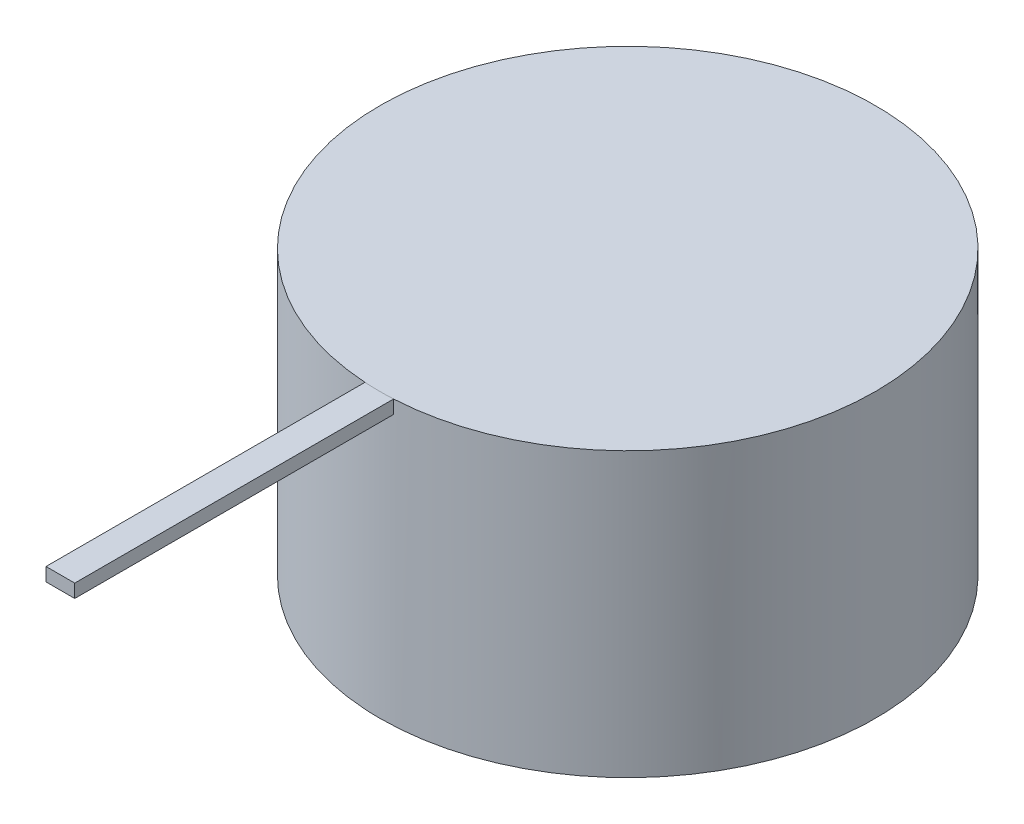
SolidWorks part; units mm, degrees
ref_plane "Front" through (0, 0, 0) normal (0, 0, 1) x (1, 0, 0)
ref_plane "Top" through (0, 0, 0) normal (0, 1, 0) x (1, 0, 0)
ref_plane "Right" through (0, 0, 0) normal (1, 0, 0) x (0, 0, -1)
sketch "Sketch1" plane through (0, 0, 0) normal (0, 1, 0) x (1, 0, 0)
  circle A0 centre (0, 0) radius 2.2924
  dimension "D1" = 4.5847
extrude "Extrude1" add sketch "Sketch1" along normal blind 1.2179
sketch "Sketch2" plane through (0, 1.2179, 0) normal (0, 1, 0) x (-1, 0, 0)
  circle A0 centre (0, 0) radius 4.445
  dimension "D1" = 8.89
extrude "Extrude2" add sketch "Sketch2" along normal blind 5.08
sketch "Sketch3" plane through (0, 0, 0) normal (0, 0, 1) x (1, 0, 0)
  line L0 (4.445, 6.2979) -> (-4.445, 6.2979) construction
  line L1 (-0.2782, 6.2979) -> (0.2375, 6.2979)
  line L2 (-0.2782, 6.2979) -> (-0.2782, 6.0581)
  line L3 (-0.2782, 6.0581) -> (0.2375, 6.0581)
  line L4 (0.2375, 6.2979) -> (0.2375, 6.0581)
  dimension "D1" = 0.2398
  dimension "D2" = 0.5157
  dimension "D3" = 0.2375
extrude "Extrude3" add sketch "Sketch3" along normal blind 10.16
sketch "Sketch4" plane through (0, 6.2979, 0) normal (0, 1, 0) x (-1, 0, 0)
  circle A0 centre (0, 0) radius 4.445
  arc A1 (-0.2375, 4.4387) -> (0.2782, 4.4363) centre (0, 0) ccw construction
